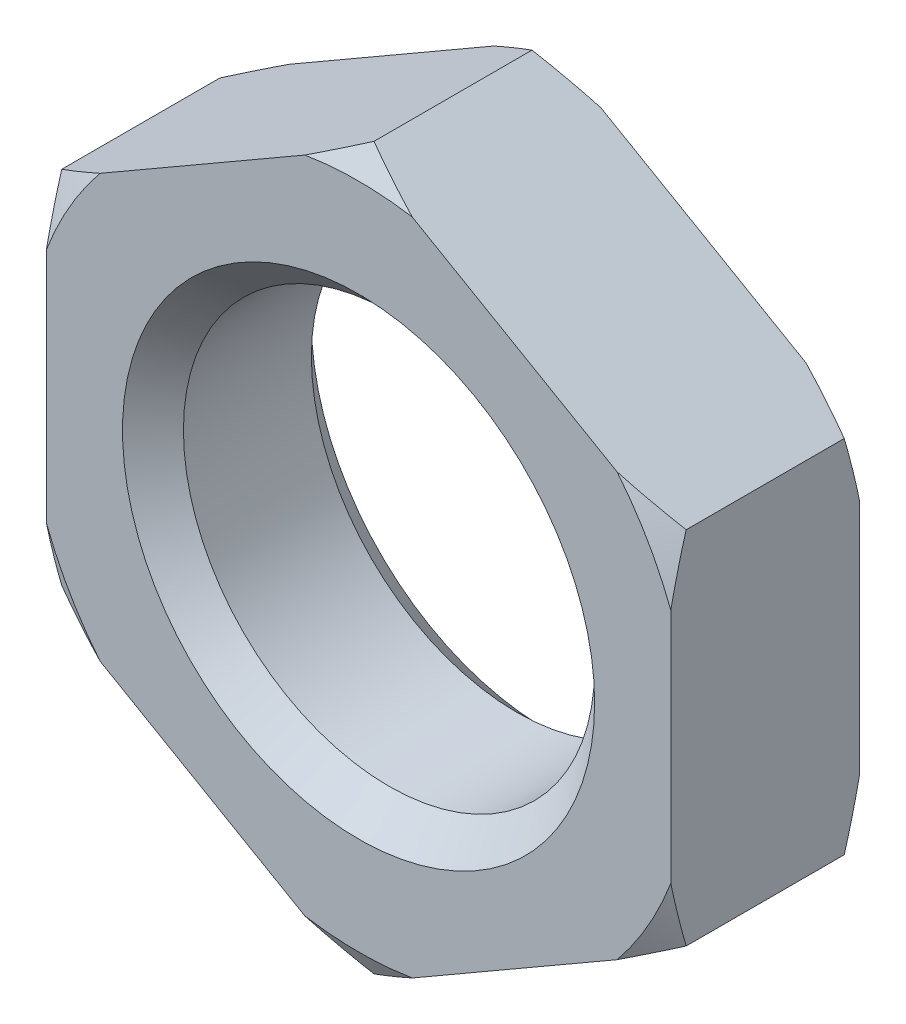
SolidWorks part; units mm, degrees
ref_plane "Front Plane" through (0, 0, 0) normal (0, 0, 1) x (1, 0, 0)
ref_plane "Top Plane" through (0, 0, 0) normal (0, 1, 0) x (1, 0, 0)
ref_plane "Right Plane" through (0, 0, 0) normal (1, 0, 0) x (0, 0, -1)
sketch "Sketch1" plane through (0, 0, 0) normal (0, 0, 1) x (1, 0, 0)
  line L1 (0, 23.6714) -> (-20.5, 11.8357)
  line L2 (-20.5, 11.8357) -> (-20.5, -11.8357)
  line L3 (-20.5, -11.8357) -> (0, -23.6714)
  line L4 (0, -23.6714) -> (20.5, -11.8357)
  line L5 (20.5, -11.8357) -> (20.5, 11.8357)
  line L6 (20.5, 11.8357) -> (0, 23.6714)
  circle A0 centre (0, 0) radius 20.5 construction
  circle A1 centre (0, 0) radius 13.5
  dimension "D2" = 27
  dimension "D1" = 41
extrude "Boss-Extrude1" add sketch "Sketch1" along normal mid plane 12.4
sketch "Sketch2" plane through (0, 0, 0) normal (1, 0, 0) x (0, 0, -1)
  line L0 (7.477, 0) -> (-8.5759, 0) construction
sketch "Sketch3" plane through (0, 0, 0) normal (1, 0, 0) x (0, 0, -1)
  line L0 (-6.2, 23.6714) -> (-6.2, 21.9214)
  line L1 (-6.2, 11.8357) -> (-6.2, 23.6714) construction
  line L2 (-6.2, 21.9214) -> (-5.1896, 23.6714)
  line L3 (-6.2, 23.6714) -> (6.2, 23.6714) construction
  line L4 (-5.1896, 23.6714) -> (-6.2, 23.6714)
  dimension "D1" = 1.75
  dimension "D2" = 30
revolve "Cut-Revolve1" cut sketch "Sketch3" angle 360 about L0
mirror "Mirror1" about plane through (0, 0, 0) normal (0, 0, 1) of "Cut-Revolve1"
chamfer "Chamfer1" distance 2 angle 45 2 edges at (13.5, 0, -6.2) (13.5, 0, 6.2)
